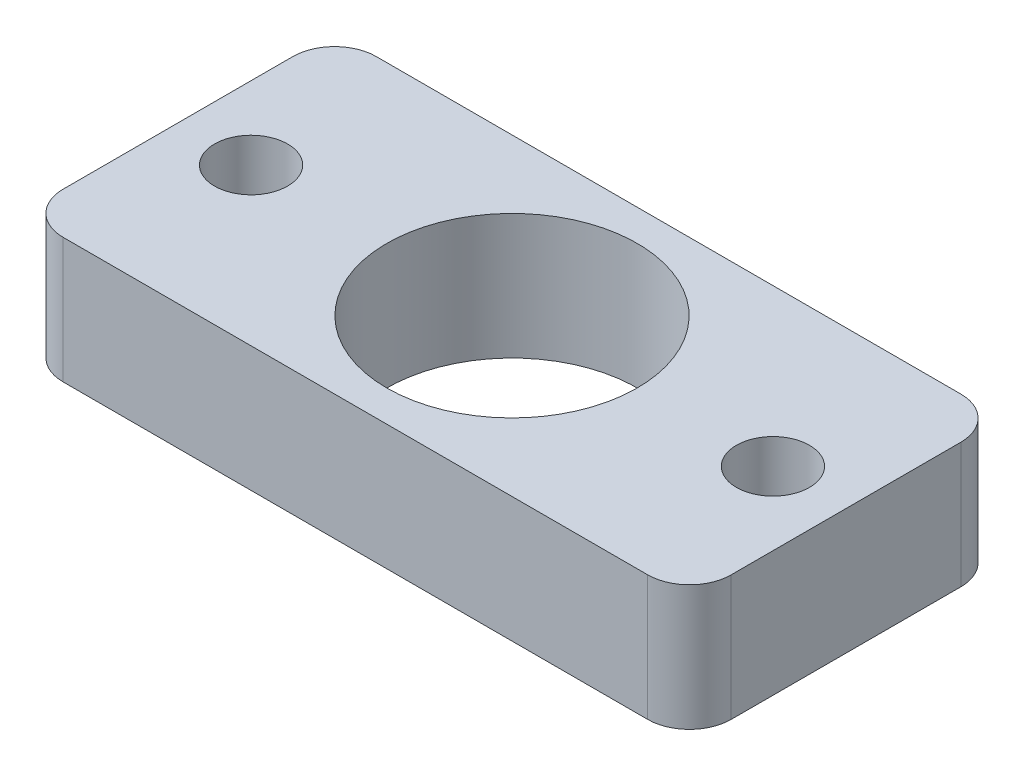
SolidWorks part; units mm, degrees
ref_plane "Front Plane" through (0, 0, 0) normal (0, 0, 1) x (1, 0, 0)
ref_plane "Top Plane" through (0, 0, 0) normal (0, 1, 0) x (1, 0, 0)
ref_plane "Right Plane" through (0, 0, 0) normal (1, 0, 0) x (0, 0, -1)
sketch "Sketch1" plane through (0, 0, 0) normal (1, 0, 0) x (0, 0, -1)
  line L1 (-7.5, -3) -> (7.5, -3)
  line L2 (-7.5, -3) -> (-7.5, 3)
  line L3 (-7.5, 3) -> (7.5, 3)
  line L4 (7.5, -3) -> (7.5, 3)
  line L5 (-7.5, -3) -> (7.5, 3) construction
  line L6 (-7.5, 3) -> (7.5, -3) construction
  point P0 (0, 0)
  dimension "D1" = 6
  dimension "D2" = 15
extrude "Boss-Extrude1" add sketch "Sketch1" along normal mid plane 32
sketch "Sketch2" plane through (0, 3, 0) normal (0, 1, 0) x (1, 0, 0)
  circle A0 centre (0, 0) radius 6
  dimension "D1" = 12
extrude "Cut-Extrude1" cut sketch "Sketch2" against normal through all
hole_wizard "Ø3.5 (3.5) Diameter Hole1" positions "Sketch4" profile "Sketch3" hole size "Ø3.5" standard "ANSI Metric"
sketch "Sketch4" plane through (0, 3, 0) normal (0, 1, 0) x (1, 0, 0)
  line L0 (-12.5, 0) -> (0, 0) construction
  line L1 (0, 0) -> (12.5, 0) construction
  point P0 (-12.5, 0)
  point P2 (12.5, 0)
  dimension "D1" = 12.5
sketch "Sketch3" plane through (-12.5, 3, 0) normal (1, 0, 0) x (0, 0, 1)
  line L0 (0, 0) -> (0, 6)
  line L1 (0, 6) -> (1.75, 6)
  line L2 (1.75, 6) -> (1.75, 0)
  line L5 (1.75, 0) -> (0, 0)
  line L11 (0, -6.35) -> (0, 107.95) construction
  dimension "Thru Hole Dia." = 3.5
  dimension "Thru Hole Depth" = 6
fillet "Fillet1" radius 2 4 edges at (-16, 0, -7.5) (-16, 0, 7.5) (16, 0, 7.5) (16, 0, -7.5)
